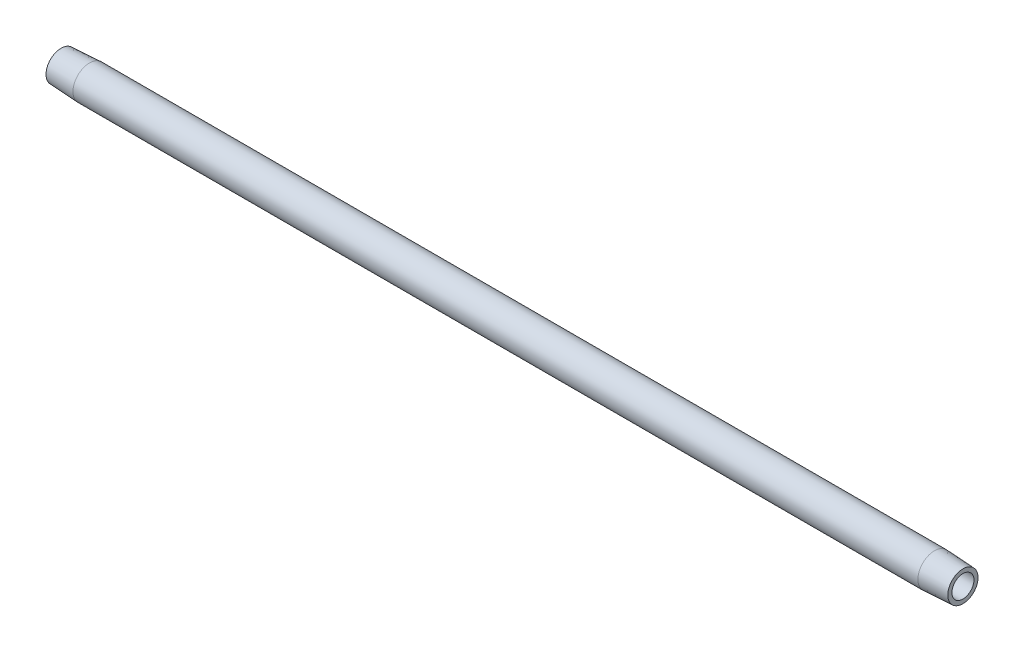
SolidWorks part; units mm, degrees
ref_plane "Front Plane" through (0, 0, 0) normal (0, 0, 1) x (1, 0, 0)
ref_plane "Top Plane" through (0, 0, 0) normal (0, 1, 0) x (1, 0, 0)
ref_plane "Right Plane" through (0, 0, 0) normal (1, 0, 0) x (0, 0, -1)
sketch "Sketch2" plane through (0, 0, 0) normal (0, 0, 1) x (1, 0, 0)
  line L0 (0.4761, 0) -> (50000.4761, 0) construction
  line L1 (0, -11.3625) -> (0, 49988.6375) construction
  line L7 (8.81, 5.1435) -> (0, 4.6818)
  line L8 (270.59, 5.1435) -> (8.81, 5.1435)
  line L9 (279.4, 4.6818) -> (270.59, 5.1435)
  line L10 (279.4, 3.4163) -> (279.4, 4.6818)
  line L11 (279.4, 3.4163) -> (0, 3.4163)
  line L12 (0, 4.6818) -> (0, 3.4163)
  dimension "D1" = 6.8326
  dimension "D2" = 10.287
  dimension "D3" = 3
  dimension "D4" = 3
  dimension "D5" = 8.81
  dimension "D6" = 8.81
  dimension "D7" = 279.4
revolve "Revolve1" add sketch "Sketch2" angle 360 about L0
